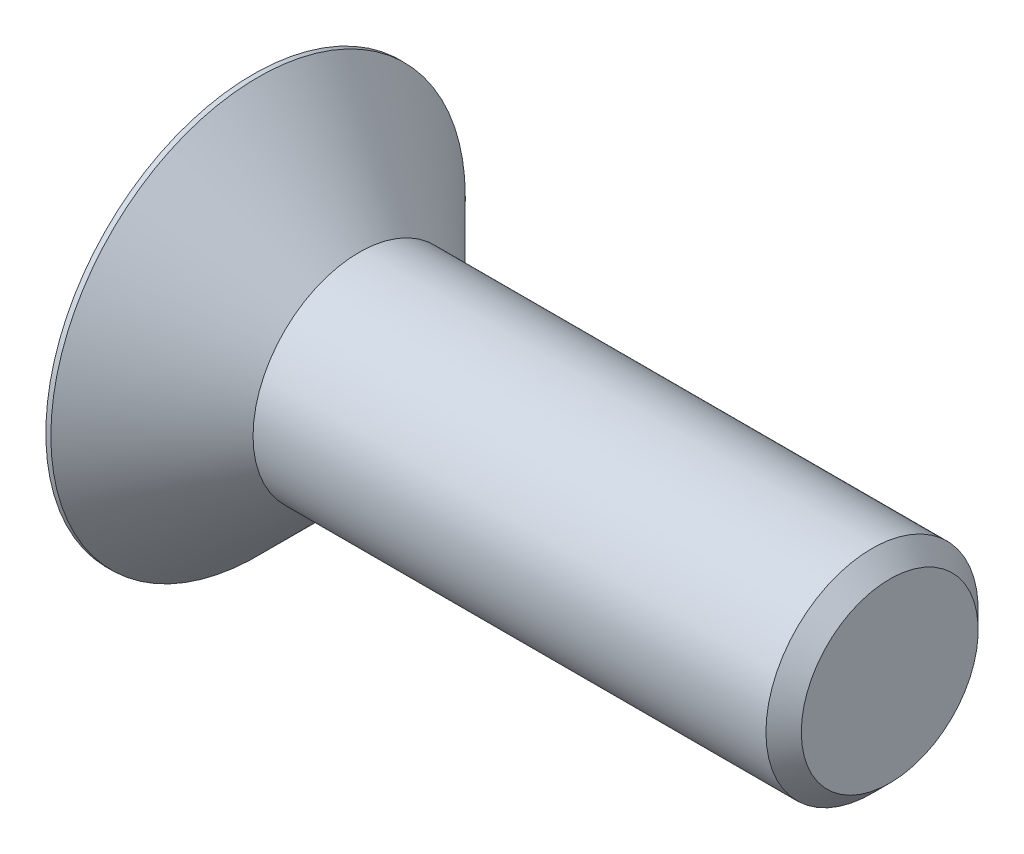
SolidWorks part; units mm, degrees
ref_plane "Ebene vorne" through (0, 0, 0) normal (0, 0, 1) x (1, 0, 0)
ref_plane "Ebene oben" through (0, 0, 0) normal (0, 1, 0) x (1, 0, 0)
ref_plane "Ebene rechts" through (0, 0, 0) normal (1, 0, 0) x (0, 0, -1)
sketch "Skizze1" plane through (0, 0, 0) normal (0, 0, 1) x (1, 0, 0)
  line L0 (0, 0) -> (2554.3716, 0) construction
  line L1 (0, 0) -> (0, 2554.3716) construction
  line L2 (0, 0) -> (0, 6)
  line L3 (0, 6) -> (3, 3)
  line L4 (3, 3) -> (18, 3)
  line L5 (18, 3) -> (18, 0)
  line L6 (18, 0) -> (0, 0)
  dimension "D1" = 6
  dimension "D2" = 45
  dimension "D3" = 12
  dimension "D4" = 18
revolve "Rotation1" add sketch "Skizze1" angle 360 about L0
chamfer "Fase1" distance 0.5 angle 45 1 edges at (18, 0, 3)
sketch "Skizze2" plane through (0, 0, 0) normal (-1, 0, 0) x (0, 0, 1)
  line L1 (1.9978, 1.4474) -> (-0.2546, 2.4538)
  line L2 (-0.2546, 2.4538) -> (-2.2524, 1.0064)
  line L3 (-2.2524, 1.0064) -> (-1.9978, -1.4474)
  line L4 (-1.9978, -1.4474) -> (0.2546, -2.4538)
  line L5 (0.2546, -2.4538) -> (2.2524, -1.0064)
  line L6 (2.2524, -1.0064) -> (1.9978, 1.4474)
  circle A0 centre (0, 0) radius 2.1365 construction
extrude "Schnitt-Linear austragen1" cut sketch "Skizze2" against normal blind 2.5
chamfer "Fase2" distance 0.2 angle 45 1 edges at (0, 0, 6)
